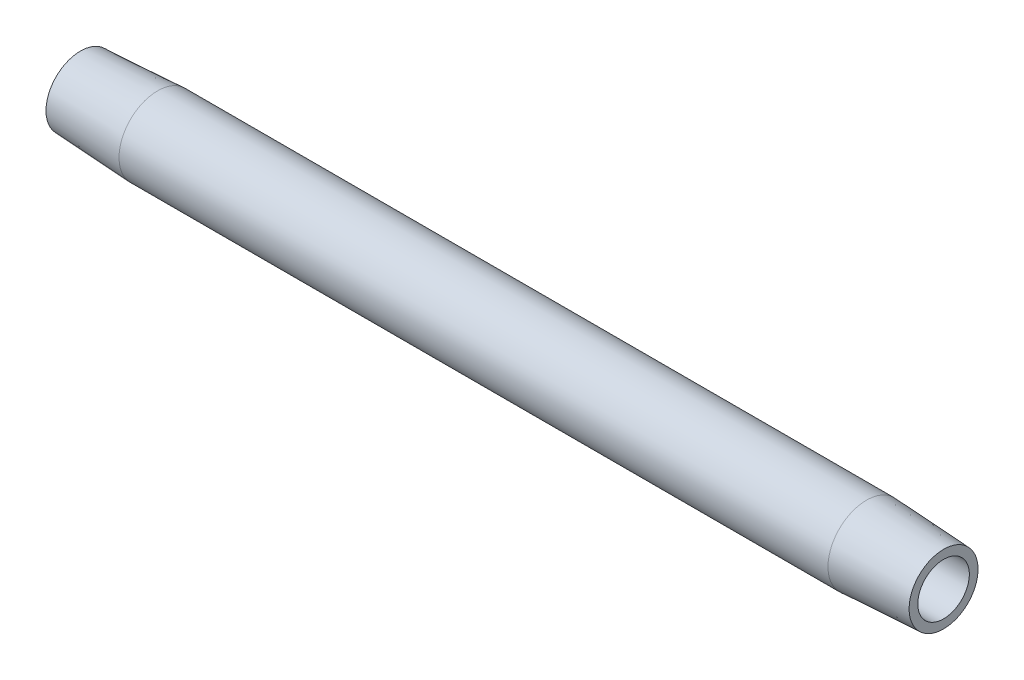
SolidWorks part; units mm, degrees
ref_plane "Front Plane" through (0, 0, 0) normal (0, 0, 1) x (1, 0, 0)
ref_plane "Top Plane" through (0, 0, 0) normal (0, 1, 0) x (1, 0, 0)
ref_plane "Right Plane" through (0, 0, 0) normal (1, 0, 0) x (0, 0, -1)
sketch "Sketch2" plane through (0, 0, 0) normal (0, 0, 1) x (1, 0, 0)
  line L0 (0.4761, 0) -> (50000.4761, 0) construction
  line L1 (0, -11.3625) -> (0, 49988.6375) construction
  line L7 (7.9375, 3.9687) -> (0, 3.5528)
  line L8 (80.9625, 3.9688) -> (7.9375, 3.9687)
  line L9 (88.9, 3.5528) -> (80.9625, 3.9688)
  line L10 (88.9, 2.6543) -> (88.9, 3.5528)
  line L11 (88.9, 2.6543) -> (0, 2.6543)
  line L12 (0, 3.5528) -> (0, 2.6543)
  dimension "D1" = 5.3086
  dimension "D2" = 7.9375
  dimension "D3" = 3
  dimension "D4" = 3
  dimension "D5" = 7.9375
  dimension "D6" = 7.9375
  dimension "D7" = 88.9
revolve "Revolve1" add sketch "Sketch2" angle 360 about L0
